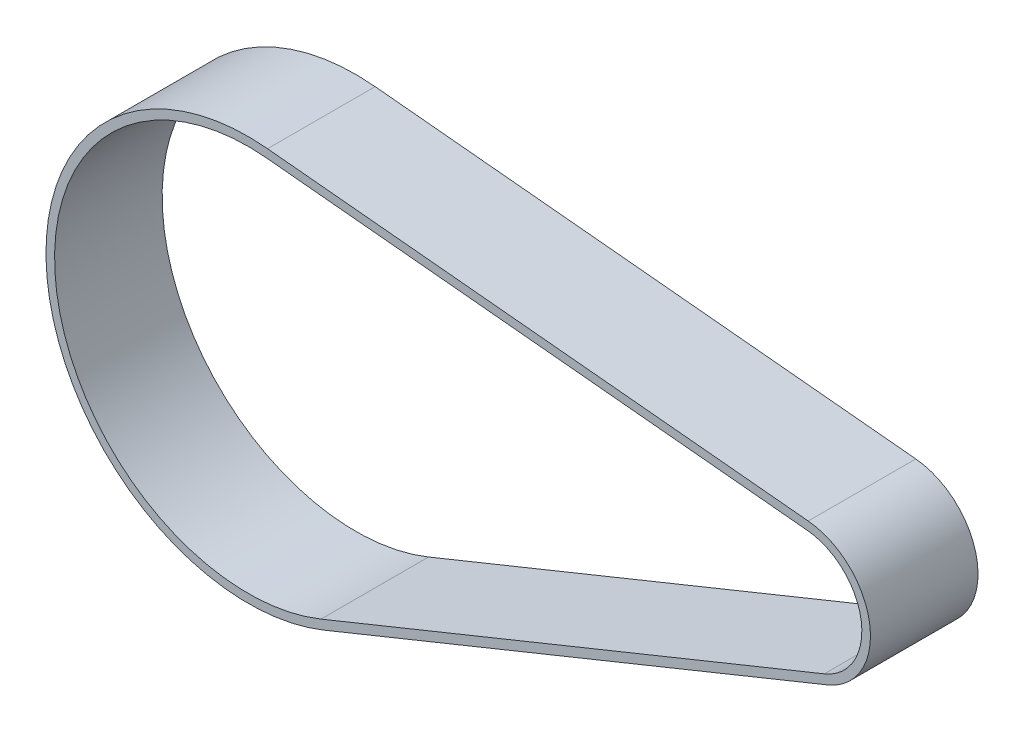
SolidWorks part; units mm, degrees
ref_plane "Plan de face" through (0, 0, 0) normal (0, 0, 1) x (1, 0, 0)
ref_plane "Plan de dessus" through (0, 0, 0) normal (0, 1, 0) x (1, 0, 0)
ref_plane "Plan de droite" through (0, 0, 0) normal (1, 0, 0) x (0, 0, -1)
sketch "Esquisse1" plane through (0, 0, 0) normal (0, 0, 1) x (1, 0, 0)
  line L0 (5.2644, -12.9725) -> (-111.7197, -60.4458)
  line L1 (1.3427, 13.9355) -> (-124.325, 26.0441)
  circle A1 centre (-128.641, -18.7485) radius 45 construction
  arc A3 (-124.325, 26.0441) -> (-111.7197, -60.4458) centre (-128.641, -18.7485) ccw
  circle A4 centre (0, 0) radius 14
  arc A5 (5.2644, -12.9725) -> (1.3427, 13.9355) centre (0, 0) ccw
  dimension "D1" = 0
extrude "Extru.-Mince1" add sketch "Esquisse1" against normal blind 25 thin
